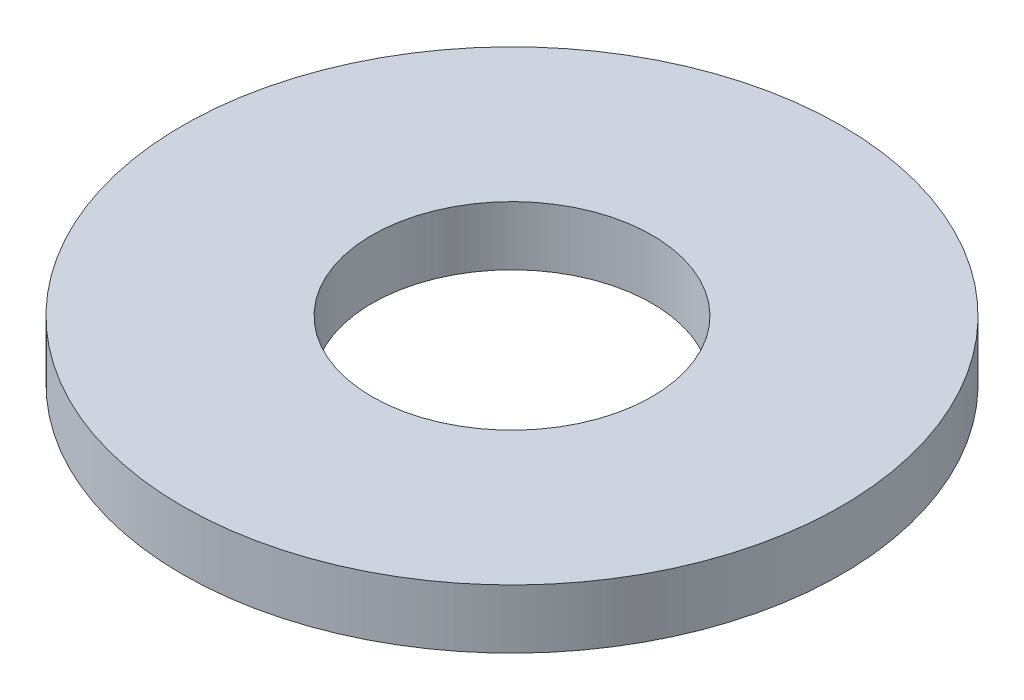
SolidWorks part; units mm, degrees
ref_plane "front" through (0, 0, 0) normal (0, 0, 1) x (1, 0, 0)
ref_plane "top" through (0, 0, 0) normal (0, 1, 0) x (1, 0, 0)
ref_plane "side" through (0, 0, 0) normal (1, 0, 0) x (0, 0, -1)
sketch "Sketch1" plane through (0, 0, 0) normal (0, 1, 0) x (1, 0, 0)
  circle A0 centre (0, 0) radius 6.7437
  circle A1 centre (0, 0) radius 15.875
  dimension "D1" = 31.75
  dimension "D2" = 13.4874
extrude "Base-Extrude" add sketch "Sketch1" along normal blind 2.8448
